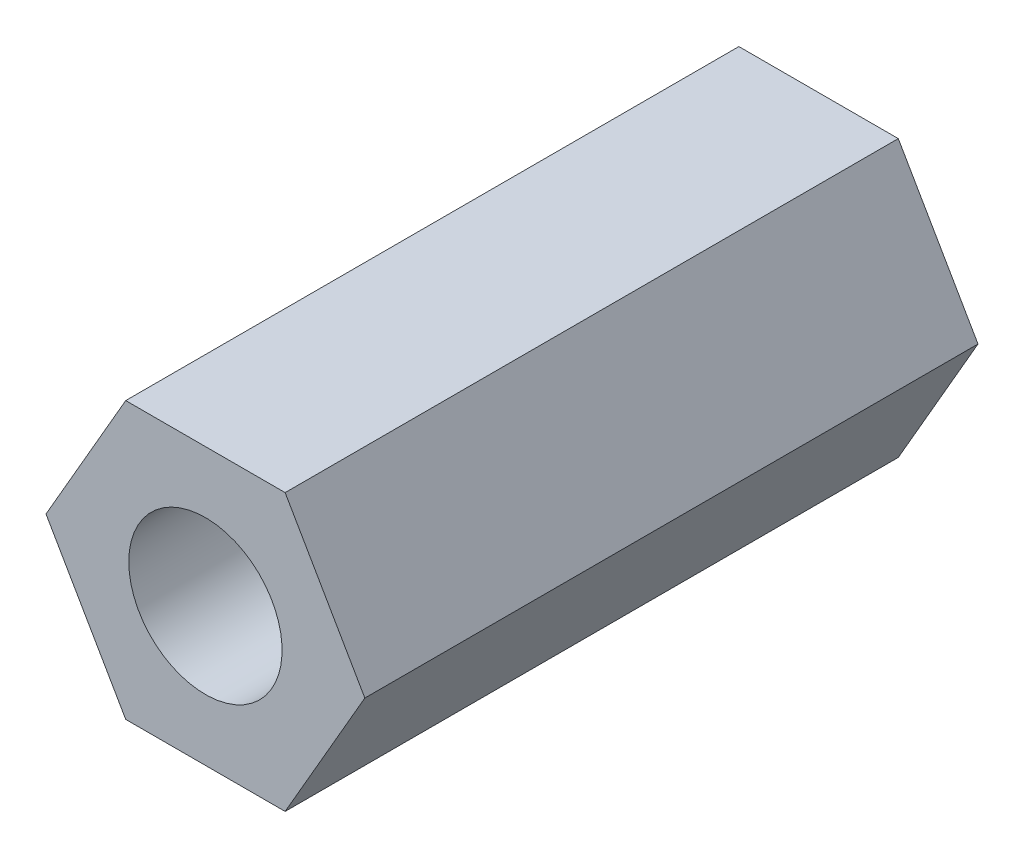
SolidWorks part; units mm, degrees
ref_plane "前视" through (0, 0, 0) normal (0, 0, 1) x (1, 0, 0)
ref_plane "上视" through (0, 0, 0) normal (0, 1, 0) x (1, 0, 0)
ref_plane "右视" through (0, 0, 0) normal (1, 0, 0) x (0, 0, -1)
sketch "草图1" plane through (0, 0, 0) normal (0, 0, 1) x (1, 0, 0)
  line L1 (2.6, 0) -> (1.3, 2.2517)
  line L2 (1.3, 2.2517) -> (-1.3, 2.2517)
  line L3 (-1.3, 2.2517) -> (-2.6, 0)
  line L4 (-2.6, 0) -> (-1.3, -2.2517)
  line L5 (-1.3, -2.2517) -> (1.3, -2.2517)
  line L6 (1.3, -2.2517) -> (2.6, 0)
  circle A0 centre (0, 0) radius 2.2517 construction
  dimension "D1" = 5.2
extrude "凸台-拉伸1" add sketch "草图1" along normal blind 10
sketch "草图2" plane through (0, 0, 10) normal (0, 0, 1) x (1, 0, 0)
  circle A0 centre (0, 0) radius 1.5
  dimension "D1" = 3
extrude "凸台-拉伸2" add sketch "草图2" along normal blind 6
hole_wizard "M3 螺纹孔1" positions "草图4" profile "草图5" tap size "M3" standard "GB"
sketch "草图4" plane through (0, 0, 0) normal (0, 0, -1) x (-1, 0, 0)
  point P0 (0, 0)
sketch "草图5" plane through (0, 0, 0) normal (1, 0, 0) x (0, 1, 0)
  line L0 (0, 0) -> (0, 10)
  line L1 (0, 10) -> (1.25, 10)
  line L2 (1.25, 10) -> (1.25, 0)
  line L5 (1.25, 0) -> (0, 0)
  line L11 (0, -6.35) -> (0, 107.95) construction
  dimension "通孔螺纹孔钻头直径" = 2.5
  dimension "通孔螺纹孔钻头深度" = 10
